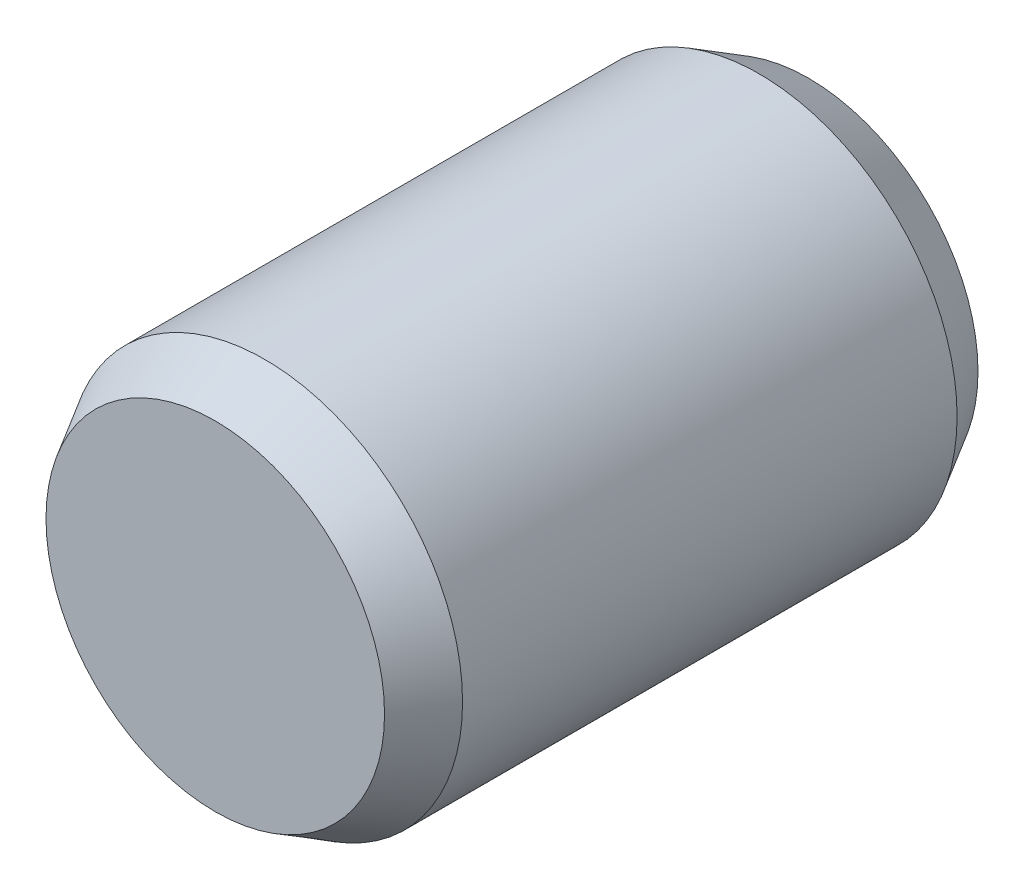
SolidWorks part; units mm, degrees
ref_plane "Plan1" through (0, 0, 0) normal (0, 0, 1) x (1, 0, 0)
ref_plane "Plan2" through (0, 0, 0) normal (0, 1, 0) x (1, 0, 0)
ref_plane "Plan3" through (0, 0, 0) normal (1, 0, 0) x (0, 0, -1)
sketch "Esquisse1" plane through (0, 0, 0) normal (0, 0, 1) x (1, 0, 0)
  circle A0 centre (50, 10) radius 4
  dimension "D1" = 8
extrude "Base-Extrusion" add sketch "Esquisse1" along normal blind 12
chamfer "Chanfrein1" distance 1 angle 30
